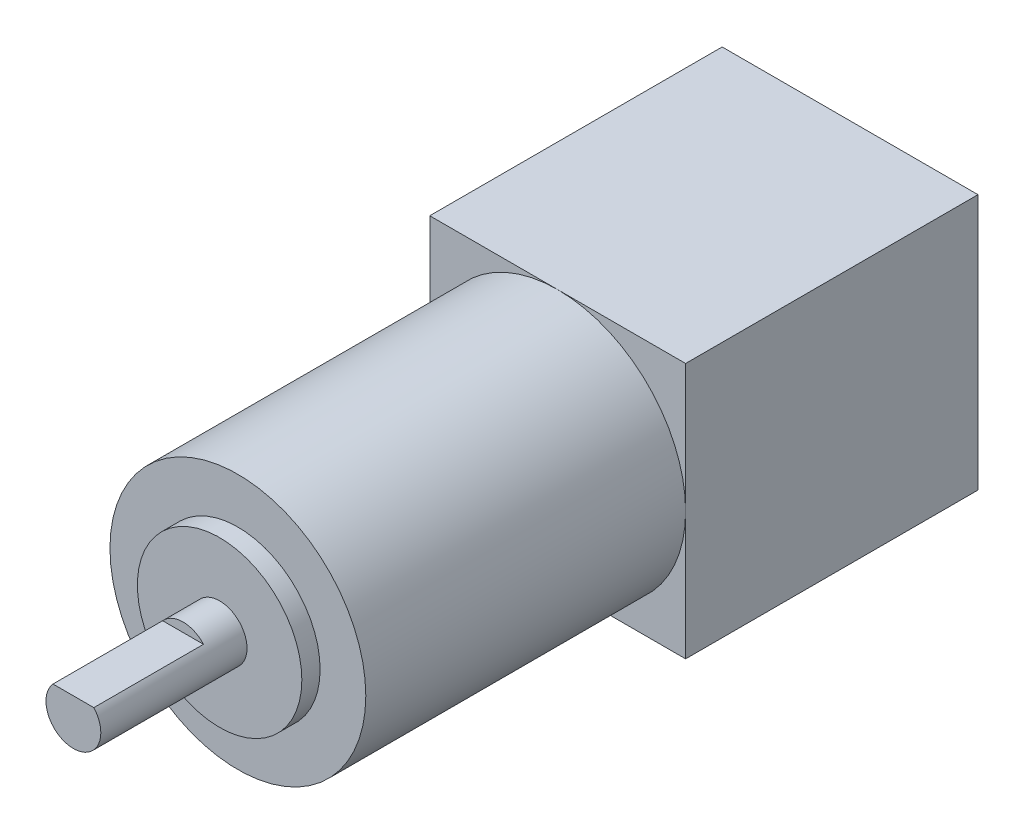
SolidWorks part; units mm, degrees
ref_plane "Front Plane" through (0, 0, 0) normal (0, 0, 1) x (1, 0, 0)
ref_plane "Top Plane" through (0, 0, 0) normal (0, 1, 0) x (1, 0, 0)
ref_plane "Right Plane" through (0, 0, 0) normal (1, 0, 0) x (0, 0, -1)
sketch "Sketch1" plane through (0, 0, 0) normal (0, 0, 1) x (1, 0, 0)
  line L1 (-14, -14) -> (14, -14)
  line L2 (-14, -14) -> (-14, 14)
  line L3 (-14, 14) -> (14, 14)
  line L4 (14, -14) -> (14, 14)
  line L5 (-14, -14) -> (14, 14) construction
  line L6 (-14, 14) -> (14, -14) construction
  point P0 (0, 0)
  dimension "D1" = 28
extrude "Boss-Extrude1" add sketch "Sketch1" along normal blind 32
sketch "Sketch2" plane through (0, 0, 32) normal (0, 0, 1) x (1, 0, 0)
  line L0 (14, -14) -> (14, 14) construction
  circle A0 centre (0, 0) radius 14
extrude "Boss-Extrude2" add sketch "Sketch2" along normal blind 35
sketch "Sketch3" plane through (0, 0, 67) normal (0, 0, 1) x (1, 0, 0)
  circle A0 centre (0, 0) radius 9
  dimension "D1" = 18
extrude "Boss-Extrude3" add sketch "Sketch3" along normal blind 2
sketch "Sketch4" plane through (0, 0, 69) normal (0, 0, 1) x (1, 0, 0)
  circle A0 centre (0, 0) radius 3
  dimension "D1" = 6
extrude "Boss-Extrude4" add sketch "Sketch4" along normal blind 16
sketch "Sketch5" plane through (0, 0, 85) normal (0, 0, 1) x (1, 0, 0)
  line L0 (-2.2361, 2) -> (2.2361, 2)
  arc A0 (-2.2361, 2) -> (2.2361, 2) centre (0, 0) ccw
  circle A1 centre (0, 0) radius 3 construction
  dimension "D1" = 5
extrude "Cut-Extrude1" cut sketch "Sketch5" against normal blind 12 flip side to cut
sketch "Sketch6" plane through (0, 0, 0) normal (0, 0, -1) x (-1, 0, 0)
  circle A0 centre (0, 0) radius 2.5
  dimension "D1" = 5
extrude "Boss-Extrude5" add sketch "Sketch6" along normal blind 10
